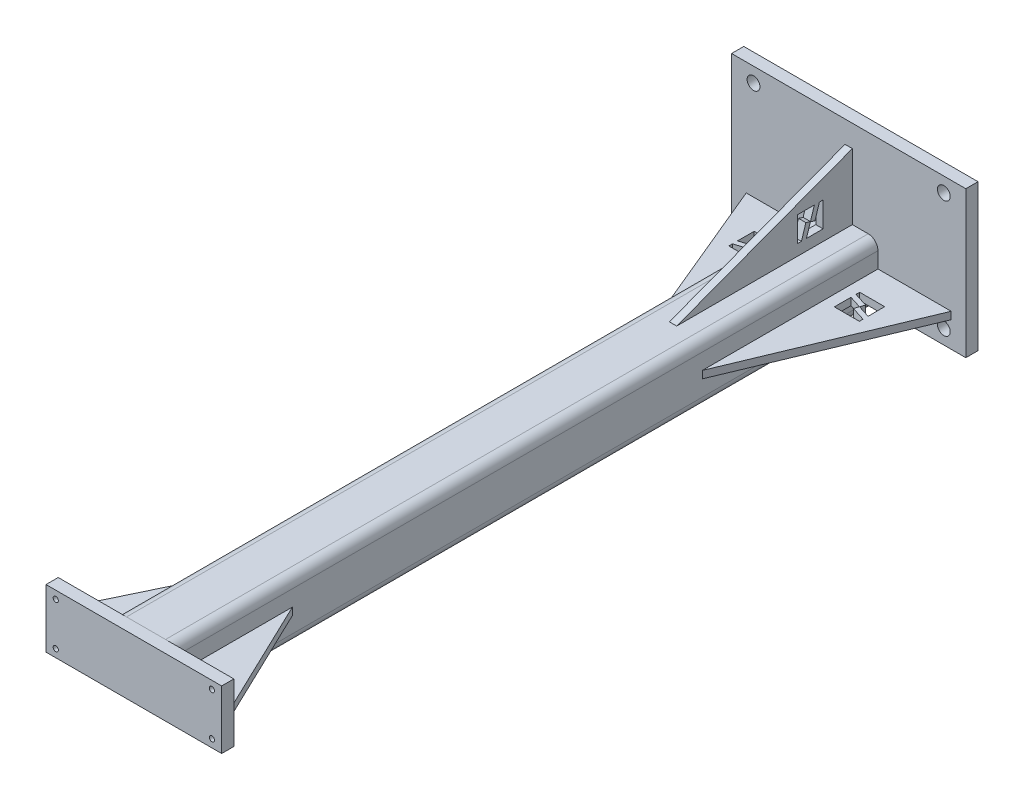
SolidWorks part; units mm, degrees
ref_plane "Front Plane" through (0, 0, 0) normal (0, 0, 1) x (1, 0, 0)
ref_plane "Top Plane" through (0, 0, 0) normal (0, 1, 0) x (1, 0, 0)
ref_plane "Right Plane" through (0, 0, 0) normal (1, 0, 0) x (0, 0, -1)
sketch3d "3DSketch1"
  line L0 (0, 0, 0) -> (0, 0, -914.4)
  dimension "D3" = 914.4
other "Tube (square) TS3X3X0.25(4)"
ref_plane "Plane1" through (0, 0, 0) normal (0, 0, -1) x (1, 0, 0)
sketch "Sketch152" plane through (0, 0, 0) normal (0, 0, -1) x (1, 0, 0)
  line L0 (-25.4, -31.75) -> (25.4, -31.75)
  line L1 (-31.75, -25.4) -> (-31.75, 25.4)
  line L2 (25.4, 31.75) -> (-25.4, 31.75)
  line L3 (31.75, 25.4) -> (31.75, -25.4)
  line L4 (-25.4, -38.1) -> (25.4, -38.1)
  line L5 (-38.1, -25.4) -> (-38.1, 25.4)
  line L6 (25.4, 38.1) -> (-25.4, 38.1)
  line L7 (38.1, 25.4) -> (38.1, -25.4)
  line L8 (-38.1, 0) -> (-31.75, 0) construction
  line L9 (-31.75, 0) -> (31.75, 0) construction
  line L10 (31.75, 0) -> (38.1, 0) construction
  line L11 (0, 38.1) -> (0, 31.75) construction
  line L12 (0, 31.75) -> (0, -31.75) construction
  line L13 (0, -31.75) -> (0, -38.1) construction
  arc A0 (38.1, 25.4) -> (25.4, 38.1) centre (25.4, 25.4) ccw
  arc A1 (25.4, -38.1) -> (38.1, -25.4) centre (25.4, -25.4) ccw
  arc A2 (-38.1, -25.4) -> (-25.4, -38.1) centre (-25.4, -25.4) ccw
  arc A3 (-25.4, 38.1) -> (-38.1, 25.4) centre (-25.4, 25.4) ccw
  arc A4 (-25.4, 31.75) -> (-31.75, 25.4) centre (-25.4, 25.4) ccw
  arc A5 (31.75, 25.4) -> (25.4, 31.75) centre (25.4, 25.4) ccw
  arc A6 (25.4, -31.75) -> (31.75, -25.4) centre (25.4, -25.4) ccw
  arc A7 (-31.75, -25.4) -> (-25.4, -31.75) centre (-25.4, -25.4) ccw
  point P6 (-38.1, -38.1)
  point P33 (-38.1, 38.1)
  point P35 (38.1, 38.1)
  point P36 (38.1, -38.1)
  point P37 (0, 0)
  dimension "D1" = 12.7
  dimension "Thickness" = 6.35
  dimension "V_leg" = 76.2
  dimension "H_leg" = 76.2
other "End cap1" [suppressed] parameters "D1"=6.35, "D2"=3.175, "D3"=3.175, "D4"=0
sketch "Sketch12" plane through (0, 0, -914.4) normal (0, 0, -1) x (-1, 0, 0)
  line L0 (0, 152.4) -> (0, -38.1) construction
  line L1 (25.4, 38.1) -> (-25.4, 38.1) construction
  line L3 (-25.4, -38.1) -> (25.4, -38.1) construction
  line L4 (-152.4, 152.4) -> (152.4, 152.4)
  line L5 (-152.4, 152.4) -> (-152.4, -38.1)
  line L6 (-152.4, -38.1) -> (152.4, -38.1)
  line L7 (152.4, 152.4) -> (152.4, -38.1)
  line L8 (-152.4, 152.4) -> (152.4, -38.1) construction
  line L9 (-152.4, -38.1) -> (152.4, 152.4) construction
  line L12 (0, 381.889) -> (0, 38.1) construction
  point P6 (0, 57.15)
  dimension "D1" = 190.5
  dimension "D2" = 304.8
extrude "Boss-Extrude1" add sketch "Sketch12" along normal blind 15.875 separate body
hole_wizard "5/8 Clearance Hole1" positions "Sketch13" profile "Sketch14" hole size "5/8" standard "ANSI Inch"
sketch "Sketch13" plane through (0, 0, -914.4) normal (0, 0, 1) x (1, 0, 0)
  line L0 (-152.4, 57.15) -> (299.7541, 57.15) construction
  line L1 (-152.4, -38.1) -> (-152.4, 152.4) construction
  line L3 (0, -38.1) -> (0, 201.525) construction
  line L4 (152.4, -38.1) -> (-152.4, -38.1) construction
  line L6 (-152.4, 152.4) -> (152.4, 152.4) construction
  point P0 (-123.825, 133.35)
  point P17 (-123.825, -19.05)
  point P19 (123.825, -19.05)
  point P20 (123.825, 133.35)
  dimension "D1" = 28.575
  dimension "D2" = 19.05
sketch "Sketch14" plane through (-123.825, 133.35, -914.4) normal (1, 0, 0) x (0, -1, 0)
  line L0 (0, 0) -> (0, 15.875)
  line L1 (0, 15.875) -> (8.3337, 15.875)
  line L2 (8.3337, 15.875) -> (8.3337, 0)
  line L5 (8.3337, 0) -> (0, 0)
  line L11 (0, -6.35) -> (0, 107.95) construction
  dimension "Thru Hole Dia." = 16.6675
  dimension "Thru Hole Depth" = 15.875
move or copy body "Body-Move/Copy1" [suppressed] bodies to move or copy 105 copy no translate (-31.75, 0, 0)
mirror "Mirror6" [suppressed] about plane through (0, 0, 0) normal (1, 0, 0)
other "Gusset1" parameters "D1"=9.525, "D2"=6.35, "D3"=0, "D4"=0, "D10"=6.35, "D11"=228.6, "D12"=95.25, "D13"=12.7, "D14"=67.751, "D15"=12.7, "D16"=76.2, "D17"=34.925, "D18"=24.624
sketch "Sketch132" plane through (-38.1, 0, -914.4) normal (0, -1, 0) x (-1, 0, 0)
  line L0 (0, 0) -> (0, -228.6)
  line L1 (0, 0) -> (95.25, 0)
  line L2 (0, -228.6) -> (95.25, 0)
sketch "Sketch134" plane through (0, 4.7625, 0) normal (0, 1, 0) x (1, 0, 0)
  line L0 (-133.35, 914.4) -> (-38.1, 914.4) construction
  line L1 (-38.1, 914.4) -> (-38.1, 685.8) construction
  line B0 (-68.5107, 859.8517) -> (-66.6966, 853.8699)
  line B1 (-66.6966, 853.8699) -> (-84.9379, 848.1165)
  line B2 (-84.9379, 848.1165) -> (-84.9379, 843.3211)
  line B3 (-84.9379, 843.3211) -> (-52.3875, 843.3211)
  line B4 (-52.3875, 843.3211) -> (-52.3875, 864.9761)
  line B5 (-52.3875, 864.9761) -> (-68.5107, 859.8517)
  line B6 (-68.8299, 859.746) -> (-70.6364, 865.7278)
  line B7 (-70.6364, 865.7278) -> (-52.3875, 871.4812)
  line B8 (-52.3875, 871.4812) -> (-52.3875, 876.3)
  line B9 (-52.3875, 876.3) -> (-84.9291, 876.3)
  line B10 (-84.9291, 876.3) -> (-84.9859, 854.6333)
  line B11 (-84.9859, 854.6333) -> (-68.8299, 859.746)
  dimension "D1" = 38.1
  dimension "D2" = 14.2875
sketch_block_instance "Block2-1"
sketch_block "Block2"
extrude "Cut-Extrude1" cut sketch "Sketch134" against normal through all
other "Gusset2" parameters "D1"=9.525, "D2"=6.35, "D3"=0, "D4"=0, "D10"=6.35, "D11"=228.6, "D12"=85.725, "D13"=12.7, "D14"=74.745, "D15"=12.7, "D16"=76.2, "D17"=31.75, "D18"=22.62
sketch "Sketch133" plane through (0, 38.1, -914.4) normal (-1, 0, 0) x (0, 0, 1)
  line L0 (0, 0) -> (228.6, 0)
  line L1 (0, 0) -> (0, 85.725)
  line L2 (228.6, 0) -> (0, 85.725)
sketch "Sketch135" plane through (-4.7625, 0, 0) normal (-1, 0, 0) x (0, 0, 1)
  line L0 (-914.4, 123.825) -> (-914.4, 38.1) construction
  line L1 (-914.4, 38.1) -> (-685.8, 38.1) construction
  line B0 (-859.7694, 68.5107) -> (-865.7512, 66.6966)
  line B1 (-865.7512, 66.6966) -> (-871.5046, 84.9379)
  line B2 (-871.5046, 84.9379) -> (-876.3, 84.9379)
  line B3 (-876.3, 84.9379) -> (-876.3, 52.3875)
  line B4 (-876.3, 52.3875) -> (-854.645, 52.3875)
  line B5 (-854.645, 52.3875) -> (-859.7694, 68.5107)
  line B6 (-859.8751, 68.8299) -> (-853.8933, 70.6364)
  line B7 (-853.8933, 70.6364) -> (-848.1399, 52.3875)
  line B8 (-848.1399, 52.3875) -> (-843.3211, 52.3875)
  line B9 (-843.3211, 52.3875) -> (-843.3211, 84.9291)
  line B10 (-843.3211, 84.9291) -> (-864.9878, 84.9859)
  line B11 (-864.9878, 84.9859) -> (-859.8751, 68.8299)
  dimension "D1" = 38.1
  dimension "D2" = 14.2875
sketch_block_instance "Block2-2"
extrude "Cut-Extrude2" cut sketch "Sketch135" against normal through all
ref_plane "Plane2" through (0, 0, 0) normal (-1, 0, 0) x (0, 0, 1)
mirror "Mirror3" about plane through (0, 0, 0) normal (-1, 0, 0)
sketch "Sketch136" plane through (0, 0, 0) normal (0, 0, 1) x (1, 0, 0)
  line L1 (25.4, -38.1) -> (-25.4, -38.1) construction
  line L2 (0, -31.75) -> (0, -38.1) construction
  line L3 (25.4, -31.75) -> (-25.4, -31.75) construction
  line L4 (-25.4, 38.1) -> (25.4, 38.1) construction
  line L8 (-114.3, 38.1) -> (-114.3, -38.1)
  line L9 (-114.3, -38.1) -> (114.3, -38.1)
  line L10 (114.3, -38.1) -> (114.3, 38.1)
  line L11 (114.3, 38.1) -> (-114.3, 38.1)
  dimension "D1" = 228.6
extrude "Boss-Extrude2" add sketch "Sketch136" along normal blind 15.875 separate body
hole_wizard "1/4 Clearance Hole1" positions "Sketch137" profile "Sketch138" hole size "1/4" standard "ANSI Inch"
sketch "Sketch137" plane through (0, 0, 0) normal (0, 0, -1) x (-1, 0, 0)
  line L0 (101.6, 27.7749) -> (-114.3, 27.7749) construction
  line L3 (-114.3, -27.7749) -> (101.6, -27.7749) construction
  line L6 (101.6, 27.7749) -> (101.6, -27.7749) construction
  line L8 (114.3, 38.1) -> (114.3, -38.1) construction
  line L9 (-114.3, 23.2647) -> (-114.3, 32.2851) construction
  line L10 (-114.3, -32.2851) -> (-114.3, -23.2647) construction
  point P0 (101.6, 27.7749)
  point P2 (101.6, -27.7749)
  dimension "D1" = 12.7
sketch "Sketch138" plane through (-101.6, 27.7749, 0) normal (1, 0, 0) x (0, 1, 0)
  line L0 (0, 0) -> (0, 15.875)
  line L1 (0, 15.875) -> (3.3782, 15.875)
  line L2 (3.3782, 15.875) -> (3.3782, 0)
  line L5 (3.3782, 0) -> (0, 0)
  line L11 (0, -6.35) -> (0, 107.95) construction
  dimension "Thru Hole Dia." = 6.7564
  dimension "Thru Hole Depth" = 15.875
mirror "Mirror4" about plane through (0, 0, 0) normal (-1, 0, 0) of "1/4 Clearance Hole1"
move or copy body "Body-Move/Copy2" [suppressed] bodies to move or copy 135 copy no translate (28.575, 0, 0)
sketch "Sketch139" plane through (0, 0, 0) normal (0, 1, 0) x (1, 0, 0)
  line L0 (104.9782, 0) -> (98.2218, 0) construction
  line L1 (111.125, 0) -> (38.1, 152.4)
  line L2 (114.3, -15.875) -> (114.3, 0) construction
  line L3 (38.1, 914.4) -> (38.1, 0) construction
  line L4 (111.125, 0) -> (38.1, 0)
  line L5 (38.1, 0) -> (38.1, 152.4)
  dimension "D1" = 3.175
  dimension "D2" = 152.4
extrude "Boss-Extrude3" add sketch "Sketch139" along normal mid plane 9.525 separate body
mirror "Mirror5" about plane through (0, 0, 0) normal (-1, 0, 0)
hole_wizard "1/4-20 Tapped Hole1" positions "Sketch140" profile "Sketch141" tap size "1/4-20" standard "ANSI Inch"
sketch "Sketch140" plane through (0, 0, 12.7) normal (0, 0, 1) x (1, 0, 0)
  point P0 (69.3356, -22.6187)
  point P3 (147.9105, -22.6187)
  point P6 (147.9105, 22.6187)
  point P9 (69.3356, 22.6187)
  point P12 (-75.6857, -22.6187)
  point P15 (-75.6857, 22.6187)
  point P18 (-154.2606, -22.6187)
  point P27 (-154.2606, 22.6187)
sketch "Sketch141" plane through (69.3356, -22.6187, 12.7) normal (1, 0, 0) x (0, -1, 0)
  line L0 (0, 0) -> (0, 482.6)
  line L1 (0, 482.6) -> (2.5527, 482.6)
  line L2 (2.5527, 482.6) -> (2.5527, 0)
  line L5 (2.5527, 0) -> (0, 0)
  line L11 (0, -6.35) -> (0, 107.95) construction
  dimension "Thru Tap Drill Dia." = 5.1054
  dimension "Thru Tap Drill Depth" = 482.6
delete or keep bodies "Body-Delete/Keep 1" [suppressed] type delete bodies bodies 137 138 139
sketch "Sketch142" [suppressed] plane through (0, -38.1, 0) normal (0, 1, 0) x (1, 0, 0)
  line L0 (-25.4, 0) -> (25.4, 0) construction
  line L1 (50.8, 0) -> (-50.8, 0)
  line L2 (50.8, 0) -> (50.8, 210.6422)
  line L3 (50.8, 210.6422) -> (-50.8, 210.6422)
  line L4 (-50.8, 0) -> (-50.8, 210.6422)
  line L5 (50.8, 0) -> (-50.8, 210.6422) construction
  line L6 (50.8, 210.6422) -> (-50.8, 0) construction
  line L7 (0, 105.3211) -> (0, 0) construction
  line L8 (25.4, 0) -> (-25.4, 0) construction
  point P0 (0, 105.3211)
  dimension "D1" = 210.6422
  dimension "D2" = 101.6
extrude "Boss-Extrude4" [suppressed] add sketch "Sketch142" against normal blind 12.7 separate body
other "End cap2" [suppressed] parameters "D1"=6.35, "D2"=3.175, "D3"=3.175, "D4"=0
hole_wizard "#10 Clearance Hole2" positions "Sketch143" profile "Sketch144" hole size "#10" standard "ANSI Inch"
sketch "Sketch143" plane through (0, -38.1, 0) normal (0, 1, 0) x (1, 0, 0)
  line L0 (-50.8, 6.7628) -> (-44.45, 6.7628) construction
  line L2 (-50.8, 48.8252) -> (-44.45, 48.8252) construction
  line L7 (-44.45, 6.7628) -> (-44.45, 48.8252) construction
  line L9 (-50.8, 105.3211) -> (-102.5494, 105.3211) construction
  line L10 (-50.8, 210.6422) -> (-50.8, 0) construction
  line L12 (0, 0) -> (0, -123.7907) construction
  line L13 (25.4, 0) -> (-25.4, 0) construction
  line L14 (-44.45, 27.794) -> (-50.8, 27.794) construction
  line L16 (-44.45, 27.794) -> (-38.1, 27.794) construction
  line L18 (-38.1, 762) -> (-38.1, 0) construction
  point P0 (-44.45, 6.7628)
  point P6 (-44.45, 48.8252)
  point P33 (-44.45, 203.8794)
  point P34 (-44.45, 161.817)
  point P42 (44.45, 203.8794)
  point P43 (44.45, 161.817)
  point P44 (44.45, 48.8252)
  point P45 (44.45, 6.7628)
sketch "Sketch144" plane through (-44.45, -38.1, -6.7628) normal (1, 0, 0) x (0, 0, 1)
  line L0 (0, 0) -> (0, 12.7)
  line L1 (0, 12.7) -> (2.5527, 12.7)
  line L2 (2.5527, 12.7) -> (2.5527, 0)
  line L5 (2.5527, 0) -> (0, 0)
  line L11 (0, -6.35) -> (0, 107.95) construction
  dimension "Thru Hole Dia." = 5.1054
  dimension "Thru Hole Depth" = 12.7
hole_wizard "1/4-20 Tapped Hole2" positions "Sketch145" profile "Sketch146" tap size "1/4-20" standard "ANSI Inch"
sketch "Sketch145" plane through (0, -50.8, 0) normal (0, -1, 0) x (-1, 0, 0)
  point P0 (22.6187, 67.0814)
  point P3 (-22.6187, 67.0814)
  point P6 (-22.6187, 143.5735)
  point P9 (22.6187, 143.5735)
sketch "Sketch146" plane through (-22.6187, -50.8, -67.0814) normal (1, 0, 0) x (0, 0, -1)
  line L0 (0, 0) -> (0, 203.2)
  line L1 (0, 203.2) -> (2.5527, 203.2)
  line L2 (2.5527, 203.2) -> (2.5527, 0)
  line L5 (2.5527, 0) -> (0, 0)
  line L11 (0, -6.35) -> (0, 107.95) construction
  dimension "Thru Tap Drill Dia." = 5.1054
  dimension "Thru Tap Drill Depth" = 203.2
sketch "Sketch147" [suppressed] plane through (0, -50.8, 0) normal (0, -1, 0) x (-1, 0, 0)
  line L1 (6.604, 77.0001) -> (-6.604, 77.0001)
  line L2 (6.604, 77.0001) -> (6.604, 133.6548)
  line L3 (6.604, 133.6548) -> (-6.604, 133.6548)
  line L4 (-6.604, 77.0001) -> (-6.604, 133.6548)
extrude "Cut-Extrude3" [suppressed] cut sketch "Sketch147" against normal up to surface (19.05 mm away)
fillet "Fillet1" [suppressed] radius 1.5875
mirror "Mirror7" [suppressed] about plane through (0, 0, 0) normal (1, 0, 0)
sketch "Sketch148" [suppressed] plane through (0, -3.175, 0) normal (0, -1, 0) x (1, 0, 0)
  line L0 (-6.35, 0) -> (-156.2354, 0) construction
  line L1 (-69.85, 0) -> (69.85, 0)
  line L2 (-69.85, 0) -> (-69.85, -228.6)
  line L3 (-69.85, -228.6) -> (69.85, -228.6)
  line L4 (69.85, 0) -> (69.85, -228.6)
  line L5 (-69.85, -457.2) -> (-69.85, 0) construction
  line L6 (69.85, -457.2) -> (69.85, 0) construction
  line L7 (-69.85, -457.2) -> (-69.85, 0) construction
extrude "Cut-Extrude4" [suppressed] cut sketch "Sketch148" against normal through all
sketch "Sketch149" [suppressed] plane through (0, 0, 0) normal (0, 0, 1) x (1, 0, 0)
  line L1 (-6.35, 38.1) -> (6.35, 38.1)
  line L2 (-6.35, 38.1) -> (-6.35, -38.1)
  line L3 (-6.35, -38.1) -> (6.35, -38.1)
  line L4 (6.35, 38.1) -> (6.35, -38.1)
extrude "Cut-Extrude5" [suppressed] cut sketch "Sketch149" against normal up to surface (457.2 mm away)
sketch "Sketch150" [suppressed] plane through (0, 0, 0) normal (0, 0, 1) x (1, 0, 0)
  line L1 (-6.35, 38.1) -> (6.35, 38.1)
  line L2 (-6.35, 38.1) -> (-6.35, 31.75)
  line L3 (-6.35, 31.75) -> (6.35, 31.75)
  line L4 (6.35, 38.1) -> (6.35, 31.75)
  line L5 (-6.35, -31.75) -> (6.35, -31.75)
  line L6 (-6.35, -31.75) -> (-6.35, -38.1)
  line L7 (-6.35, -38.1) -> (6.35, -38.1)
  line L8 (6.35, -31.75) -> (6.35, -38.1)
extrude "Boss-Extrude5" [suppressed] add sketch "Sketch150" against normal up to surface (457.2 mm away)
